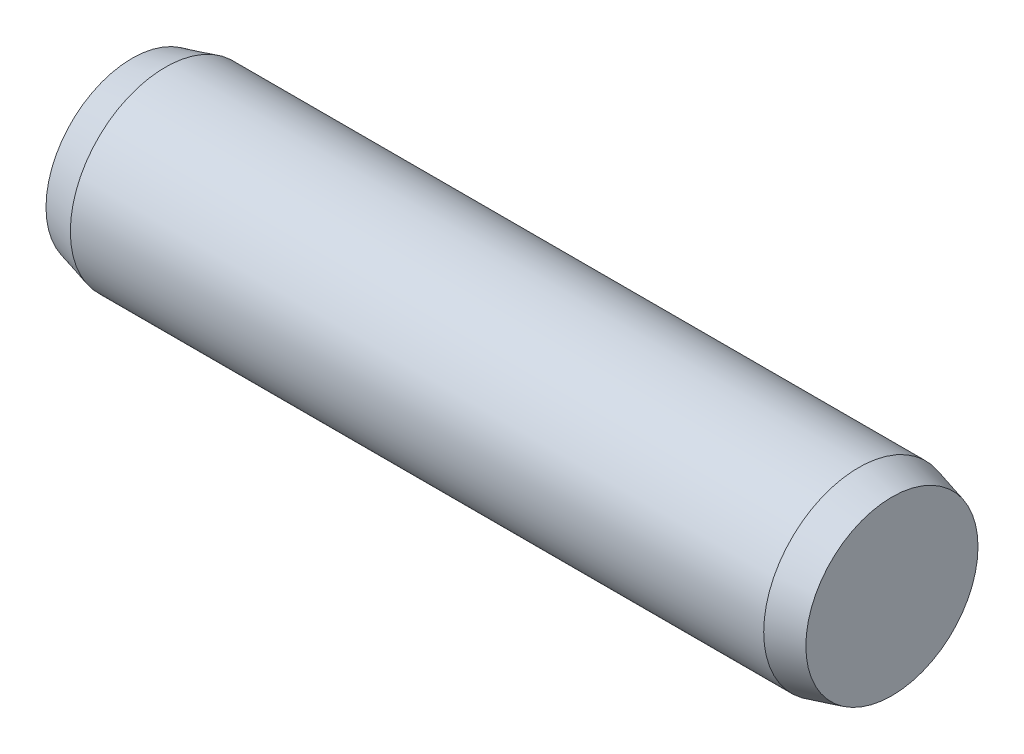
SolidWorks part; units mm, degrees
ref_plane "Plane1" through (0, 0, 0) normal (0, 0, 1) x (1, 0, 0)
ref_plane "Plane2" through (0, 0, 0) normal (0, 1, 0) x (1, 0, 0)
ref_plane "Plane3" through (0, 0, 0) normal (1, 0, 0) x (0, 0, -1)
revolve "Base-Revolve" add sketch "Sketch1" angle 360 about L1
sketch "Sketch1" plane through (0, 0, 0) normal (0, 0, 1) x (1, 0, 0)
  line L1 (-6.35, 0) -> (107.95, 0) construction
  line L2 (0, 0) -> (8, 0)
  line L3 (8, 0) -> (8, 0.9062)
  line L4 (8, 0.9062) -> (7.65, 1)
  line L5 (7.65, 1) -> (0.35, 1)
  line L6 (0, 0.9062) -> (0, 0)
  line L7 (0, 0.9062) -> (0.35, 1)
  dimension "D1" = 0.35
  dimension "D2" = 15
  dimension "D3" = 15
  dimension "Diameter" = 2
  dimension "Length" = 8
  dimension "Chamfer_len" = 0.35
sketch "Esquisse1" plane through (0, 0, 0) normal (0, 0, 1) x (1, 0, 0)
  line L0 (8, 0) -> (0, 0) construction
  line L1 (8, -0.9062) -> (8, 0.9062) construction
  point P5 (4, 0)
ref_plane "Plan milieu" through (4, 0, 0) normal (1, 0, 0) x (0, 0, -1)
equation "\"D3@Sketch1\" = 15.0"
equation "\"D1@Sketch1\" = \"Chamfer_len@Sketch1\""
equation "\"D2@Sketch1\" = \"D3@Sketch1\""
